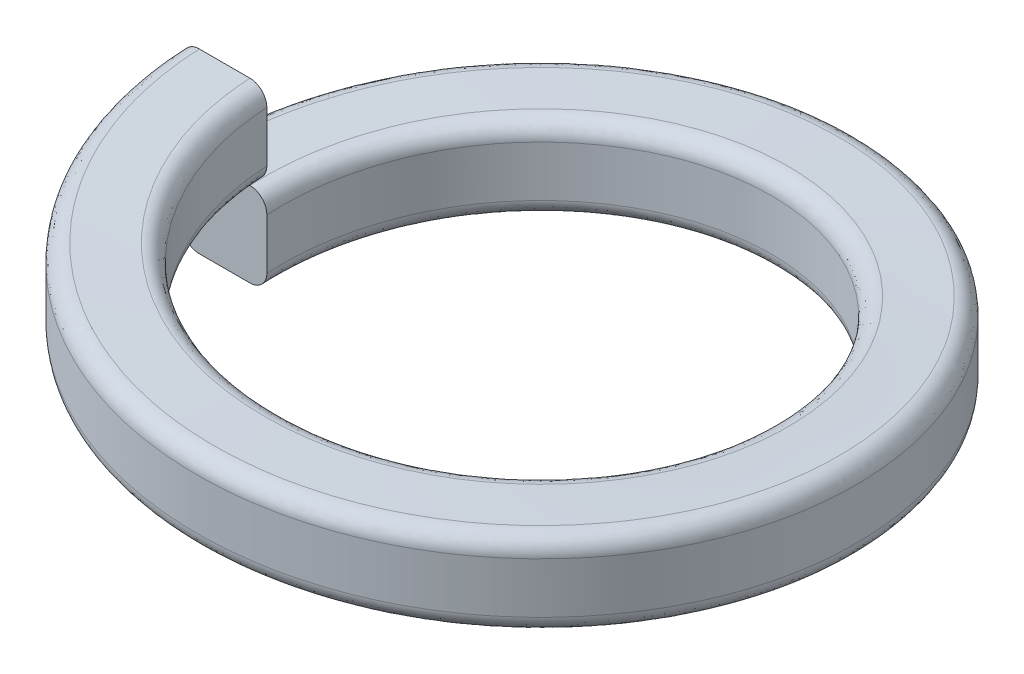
SolidWorks part; units mm, degrees
ref_plane "前视基准面" through (0, 0, 0) normal (0, 0, 1) x (1, 0, 0)
ref_plane "上视基准面" through (0, 0, 0) normal (0, 1, 0) x (1, 0, 0)
ref_plane "右视基准面" through (0, 0, 0) normal (1, 0, 0) x (0, 0, -1)
sketch "草图4" plane through (0, 0, 0) normal (0, 1, 0) x (1, 0, 0)
  circle A0 centre (0, 0) radius 3.5
  dimension "D1" = 7
curve "螺旋线/涡状线2"
sketch "草图9" plane through (0, 0, 0) normal (0, 0, 1) x (1, 0, 0)
  line L1 (-3.9026, 1.5587) -> (-2.9026, 1.5587)
  line L2 (-3.9026, 1.5587) -> (-3.9026, 0.5587)
  line L3 (-3.9026, 0.5587) -> (-2.9026, 0.5587)
  line L4 (-2.9026, 1.5587) -> (-2.9026, 0.5587)
  line L5 (-3.9026, 1.5587) -> (-2.9026, 0.5587) construction
  line L6 (-3.9026, 0.5587) -> (-2.9026, 1.5587) construction
  spline S1 degree 3 poles (-3.5, 0) (-3.5, 0.0228) (-3.3178, 0.0688) (-2.5393, 0.1375) (-1.3743, 0.2063) (0, 0.275) (1.3743, 0.3438) (2.5393, 0.4125) (3.3178, 0.4813) (3.5911, 0.55) (3.3178, 0.6187) (2.5393, 0.6875) (1.3743, 0.7562) (0, 0.825) (-1.3743, 0.8937) (-2.5393, 0.9625) (-3.3178, 1.0312) (-3.5, 1.0772) (-3.5, 1.1) knots 0 0 0 0 0.0625 0.125 0.1875 0.25 0.3125 0.375 0.4375 0.5 0.5625 0.625 0.6875 0.75 0.8125 0.875 0.9375 1 1 1 1 construction
  point P0 (-3.4026, 1.0587)
  dimension "D1" = 1
  dimension "D2" = 1
sweep "扫描7" add profiles "草图9" path "螺旋线/涡状线2"
fillet "圆角1" radius 0.2 2 edges
fillet "圆角2" radius 0.2 2 edges
